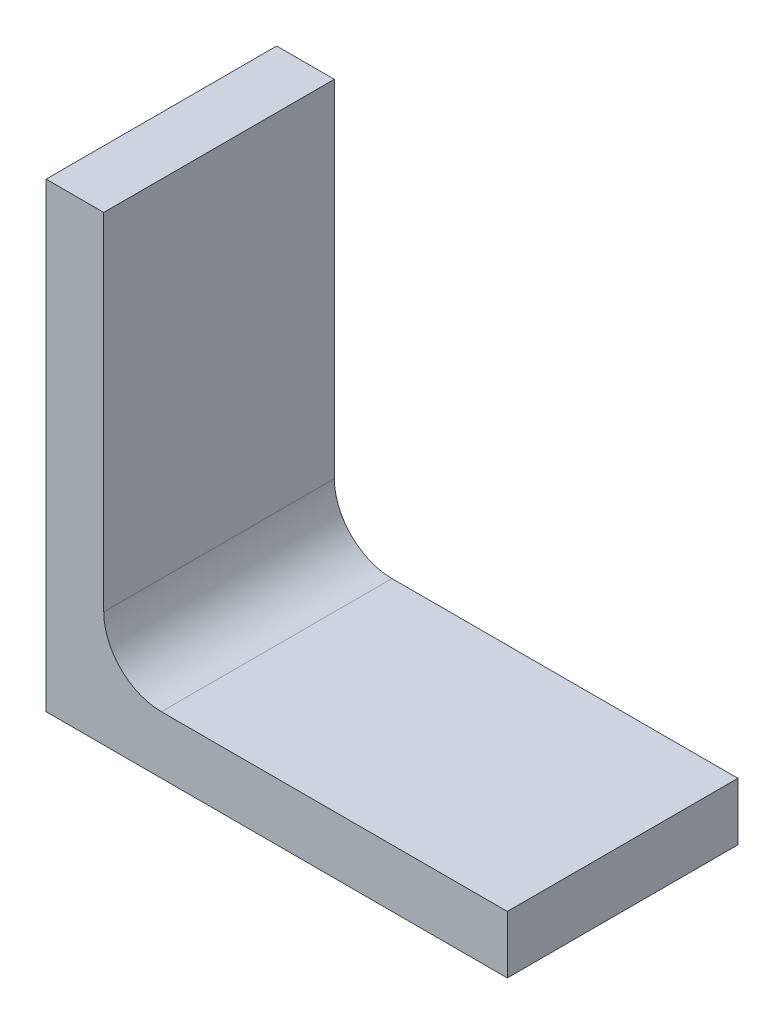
SolidWorks part; units mm, degrees
ref_plane "Plane1" through (0, 0, 0) normal (0, 0, 1) x (1, 0, 0)
ref_plane "Plane2" through (0, 0, 0) normal (0, 1, 0) x (1, 0, 0)
ref_plane "Plane3" through (0, 0, 0) normal (1, 0, 0) x (0, 0, -1)
sketch "Sketch1" plane through (0, 0, 0) normal (0, 0, 1) x (1, 0, 0)
  line L0 (0, 0) -> (0, 50.8)
  line L1 (0, 50.8) -> (12.7, 50.8) construction
  line L2 (6.35, 50.8) -> (6.35, 12.7)
  line L3 (12.7, 6.35) -> (50.8, 6.35)
  line L4 (50.8, 12.7) -> (50.8, 0) construction
  line L5 (50.8, 0) -> (0, 0)
  line L6 (0, 50.8) -> (6.35, 50.8)
  line L7 (50.8, 0) -> (50.8, 6.35)
  arc A2 (12.7, 6.35) -> (6.35, 12.7) centre (12.7, 12.7) cw
  dimension "Radius_1" = 6.35
  dimension "D1" = 6.35
  dimension "V_leg" = 50.8
  dimension "H_leg" = 50.8
  dimension "Thickness" = 6.35
extrude "BaseAnglese" add sketch "Sketch1" along normal mid plane 25.4
equation "\"D1@Sketch1\" = \"Thickness@Sketch1\""
